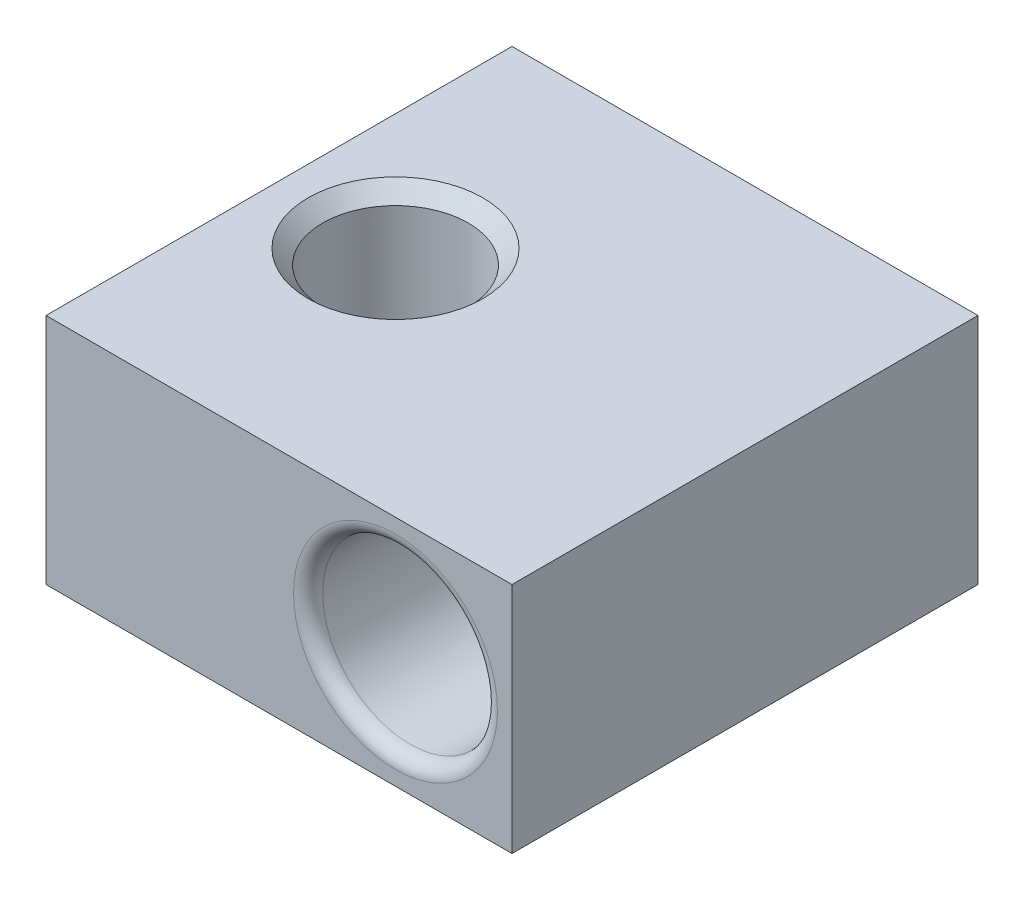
SolidWorks part; units mm, degrees
ref_plane "Plan de face" through (0, 0, 0) normal (0, 0, 1) x (1, 0, 0)
ref_plane "Plan de dessus" through (0, 0, 0) normal (0, 1, 0) x (1, 0, 0)
ref_plane "Plan de droite" through (0, 0, 0) normal (1, 0, 0) x (0, 0, -1)
sketch "Esquisse1" plane through (0, 0, 0) normal (0, 0, 1) x (1, 0, 0)
  line L1 (0, 0) -> (16, 0)
  line L2 (0, 0) -> (0, 8)
  line L3 (0, 8) -> (16, 8)
  line L4 (16, 0) -> (16, 8)
  circle A0 centre (12, 4) radius 3
  point P7 (0, 0)
  point P8 (16, 4)
  dimension "D3" = 4
  dimension "D4" = 6
  dimension "D1" = 8
  dimension "D2" = 16
extrude "Boss.-Extru.1" add sketch "Esquisse1" along normal blind 16
sketch "Esquisse2" plane through (0, 8, 0) normal (0, 1, 0) x (1, 0, 0)
  line L0 (0, -16) -> (0, 0) construction
  circle A0 centre (4, -8) radius 2.5
  point P4 (0, -8)
  dimension "D1" = 5
  dimension "D2" = 4
extrude "Enlèv. mat.-Extru.1" cut sketch "Esquisse2" against normal through all
chamfer "Chanfrein1" distance 0.5 angle 45 2 edges at (4, 0, 10.5) (4, 8, 10.5)
fillet "Congé1" radius 0.5 2 edges at (15, 4, 0) (15, 4, 16)
